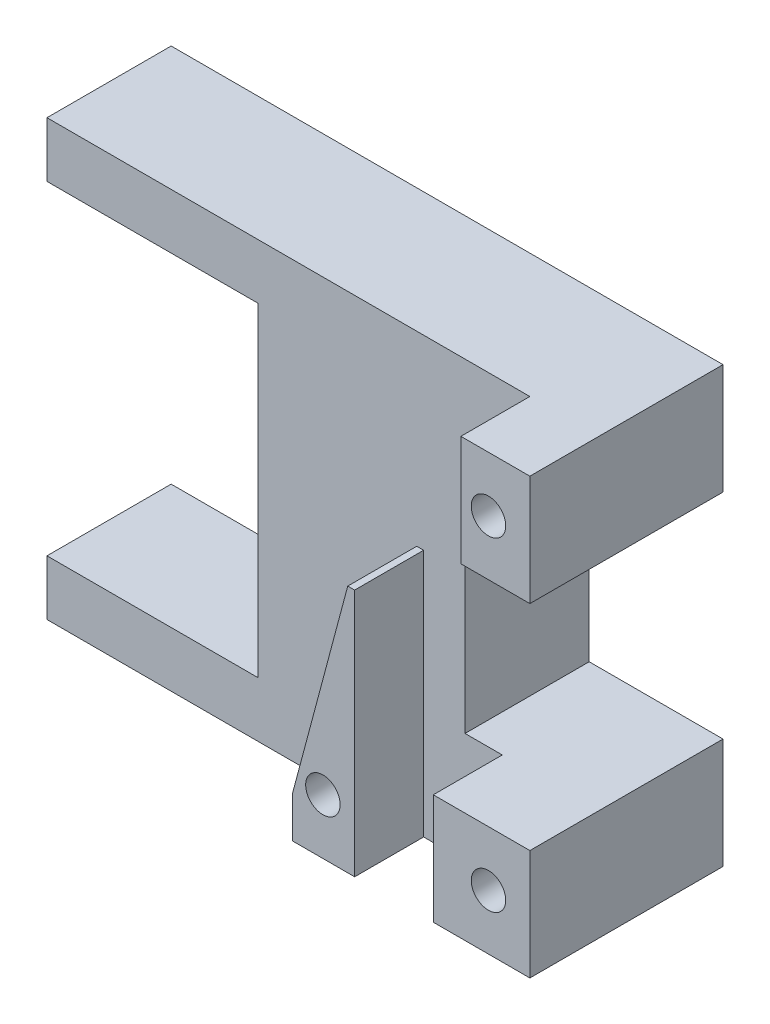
SolidWorks part; units mm, degrees
ref_plane "Front Plane" through (0, 0, 0) normal (0, 0, 1) x (1, 0, 0)
ref_plane "Top Plane" through (0, 0, 0) normal (0, 1, 0) x (1, 0, 0)
ref_plane "Right Plane" through (0, 0, 0) normal (1, 0, 0) x (0, 0, -1)
sketch "Sketch1" plane through (0, 0, 0) normal (0, 0, 1) x (-1, 0, 0)
  line L0 (-12.7933, 22.7933) -> (-12.7933, -0.7067)
  line L1 (2.5067, -4.7067) -> (-37.4933, -4.7067)
  line L2 (2.5067, -4.7067) -> (2.5067, -0.7067)
  line L3 (2.5067, -0.7067) -> (-37.4933, -0.7067)
  line L4 (-37.4933, -4.7067) -> (-37.4933, -0.7067)
  line L5 (2.5067, 26.7933) -> (-37.4933, 26.7933)
  line L6 (2.5067, 26.7933) -> (2.5067, 22.7933)
  line L7 (2.5067, 22.7933) -> (-37.4933, 22.7933)
  line L8 (-37.4933, 26.7933) -> (-37.4933, 22.7933)
  line L9 (-2.4024, 24.2995) -> (-2.5192, -3.3258)
  line L10 (-37.4933, 22.7933) -> (-37.4933, -0.7067)
  line L11 (-27.7933, 22.7933) -> (-27.7933, -0.7067)
  line L12 (-20.2933, 54.7933) -> (-20.2933, -7.7067)
  line L13 (-37.4933, 18.7933) -> (-27.7933, 18.7933)
  line L14 (-37.4933, 3.2933) -> (-27.7933, 3.2933)
  arc A0 (-15.2933, 49.7933) -> (-25.2933, 49.7933) centre (-20.2933, 49.7933) ccw construction
  dimension "D1" = 4
  dimension "D2" = 40
  dimension "D3" = 4
  dimension "D4" = 23.5
  dimension "D5" = 7.5
  dimension "D6" = 7.5
  dimension "D7" = 8
  dimension "D8" = 8
extrude "Boss-Extrude1" add sketch "Sketch1" along normal blind 9
sketch "Sketch2" plane through (0, 0, 9) normal (0, 0, 1) x (1, 0, 0)
  line L0 (37.4933, -18.7933) -> (27.7933, -18.7933) construction
  line L1 (37.4933, -26.7933) -> (30.4933, -26.7933)
  line L2 (37.4933, -26.7933) -> (37.4933, -18.7933)
  line L3 (37.4933, -18.7933) -> (30.4933, -18.7933)
  line L4 (30.4933, -26.7933) -> (30.4933, -18.7933)
  line L5 (-2.5067, 4.7067) -> (37.4933, 4.7067) construction
  line L10 (20.2933, -54.7933) -> (20.2933, -26.7933)
  line L11 (-2.5067, -26.7933) -> (37.4933, -26.7933) construction
  line L12 (20.2933, -26.7933) -> (20.2933, 4.7067)
  line L14 (37.4933, -3.2933) -> (27.7933, -3.2933) construction
  line L17 (37.4933, 4.7067) -> (32.4933, 4.7067)
  line L18 (24.7933, -26.7933) -> (20.2933, -26.7933)
  line L19 (24.7933, -26.7933) -> (24.7933, -8.7933)
  line L20 (24.7933, -8.7933) -> (20.2933, -8.7933)
  line L21 (20.2933, -26.7933) -> (20.2933, -8.7933)
  line L22 (37.4933, 4.7067) -> (37.4933, -3.2933)
  line L23 (37.4933, -3.2933) -> (32.4933, -3.2933)
  line L24 (32.4933, 4.7067) -> (32.4933, -3.2933)
  arc A0 (15.2933, -49.7933) -> (25.2933, -49.7933) centre (20.2933, -49.7933) ccw construction
  dimension "D1" = 4.5
  dimension "D2" = 5
  dimension "D3" = 18
  dimension "D4" = 7
extrude "Boss-Extrude2" add sketch "Sketch2" along normal blind 5 contours L4 M18 M19 M20 | L19 L20 L12 M18 | L24 M22 M23 M24
chamfer "Chamfer1" distance 4 distance2 15 1 edges at (20.2933, -8.7933, 11.5)
sketch "Sketch4" plane through (0, 0, 14) normal (0, 0, 1) x (1, 0, 0)
  line L0 (37.4933, -26.7933) -> (37.4933, -18.7933) construction
  line L1 (37.4933, -3.2933) -> (37.4933, 4.7067) construction
  circle A0 centre (34.4933, -22.7933) radius 1.25
  circle A1 centre (34.4933, 0.7067) radius 1.25
  circle A2 centre (22.4933, -22.7933) radius 1.25
  point P8 (37.4933, 0.7067)
  point P9 (37.4933, -22.7933)
  dimension "D1" = 2.5
  dimension "D2" = 2.5
  dimension "D5" = 2.5
  dimension "D3" = 3
  dimension "D4" = 3
  dimension "D6" = 12
extrude "Cut-Extrude1" cut sketch "Sketch4" against normal blind 5
sketch "Sketch6" plane through (0, 0, 0) normal (0, 0, -1) x (-1, 0, 0)
  line L0 (-20.2933, -54.7933) -> (-20.2933, 7.7067)
  line L1 (2.5067, -26.7933) -> (-37.4933, -26.7933) construction
  line L2 (-25.2933, -1.7933) -> (-15.2933, -1.7933) construction
  line L3 (-25.2933, -1.7933) -> (-25.2933, -21.7933) construction
  line L4 (-25.2933, -21.7933) -> (-15.2933, -21.7933) construction
  line L5 (-15.2933, -1.7933) -> (-15.2933, -21.7933) construction
  arc A0 (-25.2933, -49.7933) -> (-15.2933, -49.7933) centre (-20.2933, -49.7933) ccw construction
  circle A1 centre (-25.2933, -1.7933) radius 1.25
  circle A2 centre (-15.2933, -1.7933) radius 1.25
  circle A3 centre (-15.2933, -21.7933) radius 1.25
  circle A4 centre (-25.2933, -21.7933) radius 1.25
  point P10 (-20.2933, -1.7933)
  dimension "D4" = 2.5
  dimension "D5" = 2.5
  dimension "D6" = 2.5
  dimension "D7" = 2.5
  dimension "D1" = 10
  dimension "D2" = 20
  dimension "D3" = 5
extrude "Cut-Extrude2" cut sketch "Sketch6" against normal blind 5 contours A1 | A2 | A3 | A4
